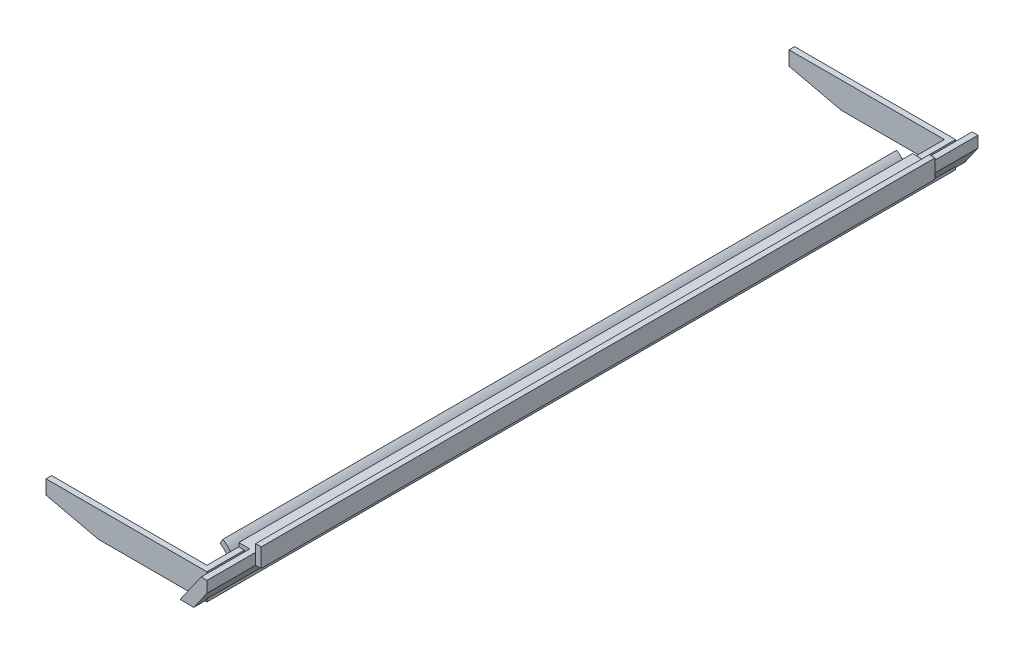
SolidWorks part; units mm, degrees
ref_plane "Face" through (0, 0, 0) normal (0, 0, 1) x (1, 0, 0)
ref_plane "Dessus" through (0, 0, 0) normal (0, 1, 0) x (1, 0, 0)
ref_plane "Droite" through (0, 0, 0) normal (1, 0, 0) x (0, 0, -1)
sketch "Esquisse1" plane through (0, 0, 0) normal (0, 0, 1) x (1, 0, 0)
  line L0 (-5, 0.3301) -> (-4.25, 1.6292)
  line L1 (0, -4) -> (-1, -4)
  line L2 (4.5, 3) -> (4.5, 5)
  line L3 (4.5, 5) -> (6, 5)
  line L4 (6, 0) -> (6, 5)
  line L5 (4.5, 3) -> (0, 3)
  line L6 (0, 0) -> (0, -4)
  line L7 (6, 0) -> (1.5, 0)
  line L8 (0, 3) -> (0, 0)
  line L10 (1.5, 0) -> (1.5, -5)
  line L12 (1.5, -5) -> (-2.5, -5)
  line L13 (-2.5, -4) -> (-2.5, -5)
  arc A0 (-2.5, -4) -> (-5, 0.3301) centre (-7.5, -4) ccw
  arc A1 (-4.25, 1.6292) -> (-1, -4) centre (-7.5, -4) cw
  dimension "D9" = 5
  dimension "D10" = 6.5
  dimension "D1" = 5
  dimension "D2" = 1.5
  dimension "D3" = 6
  dimension "D4" = 3
  dimension "D5" = 1.5
  dimension "D6" = 10
  dimension "D7" = 4
  dimension "D11" = 60
extrude "Tirette avant" add sketch "Esquisse1" along normal mid plane 180
sketch "Esquisse2" plane through (0, -5, 0) normal (0, -1, 0) x (1, 0, 0)
  line L0 (1.5, 90) -> (1.5, 100)
  line L1 (1.5, 100) -> (-41.5, 100)
  dimension "D1" = 100
extrude "Mur cotés" add sketch "Esquisse2" against normal blind 7 thin
sketch "Esquisse5" plane through (0, 0, 100) normal (0, 0, 1) x (1, 0, 0)
  line L0 (4.5, 0) -> (0.999, -5)
  line L1 (1.5, -5) -> (-41.5, -5) construction
  line L2 (1.5, 2) -> (1.5, -5) construction
  line L3 (1.5, 0) -> (6, 0) construction
  line L4 (4.5, 5) -> (4.5, 3) construction
  line L5 (4.5, 0) -> (4.5, 3)
  line L6 (4.5, 3) -> (2.9383, 3)
  line L8 (4.5, 3) -> (0, 3) construction
  line L9 (2.9383, 3) -> (-2.6634, -5)
  line L10 (-2.6634, -5) -> (0.999, -5)
  dimension "D1" = 35
  dimension "D2" = 3
extrude "Pente calage" add sketch "Esquisse5" along normal blind 3
sketch "Esquisse6" plane through (0, 0, 100) normal (0, 0, -1) x (-1, 0, 0)
  line L7 (-1.5, -4.2844) -> (-1.5, 0.9459)
  line L9 (-1.5, 0.9459) -> (-2.9383, 3)
  line L11 (-2.9383, 3) -> (-4.5, 3)
  line L12 (-4.5, 3) -> (-4.5, 0)
  line L13 (-4.5, 0) -> (-1.5, -4.2844)
  line L14 (-1.5, -4.2844) -> (-1.5, 0.9459)
  line L16 (-1.5, 0.9459) -> (-2.9383, 3)
  line L18 (-2.9383, 3) -> (-4.5, 3)
  line L19 (-4.5, 3) -> (-4.5, 0)
  line L20 (-4.5, 0) -> (-1.5, -4.2844)
  dimension "D1" = 0
extrude "Raccord" add sketch "Esquisse6" along normal up to surface (190 mm away)
mirror "Symétrie1" about plane through (0, 0, 0) normal (0, 0, 1) of "Raccord", "Pente calage", "Mur cotés"
ref_plane "Plan1" through (0, 0, 65) normal (0, 0, 1) x (1, 0, 0)
sketch "Esquisse10" plane through (0, 0, -100) normal (0, 0, -1) x (-1, 0, 0)
  line L0 (27.5, -5) -> (54.4841, 1.2298)
  line L3 (54.4841, 1.2298) -> (54.4841, -9.9702)
  line L4 (54.4841, -9.9702) -> (27.5, -9.9702)
  line L5 (27.5, -9.9702) -> (27.5, -5)
extrude "Enlèv. mat.-Extru.1" cut sketch "Esquisse10" against normal through all
